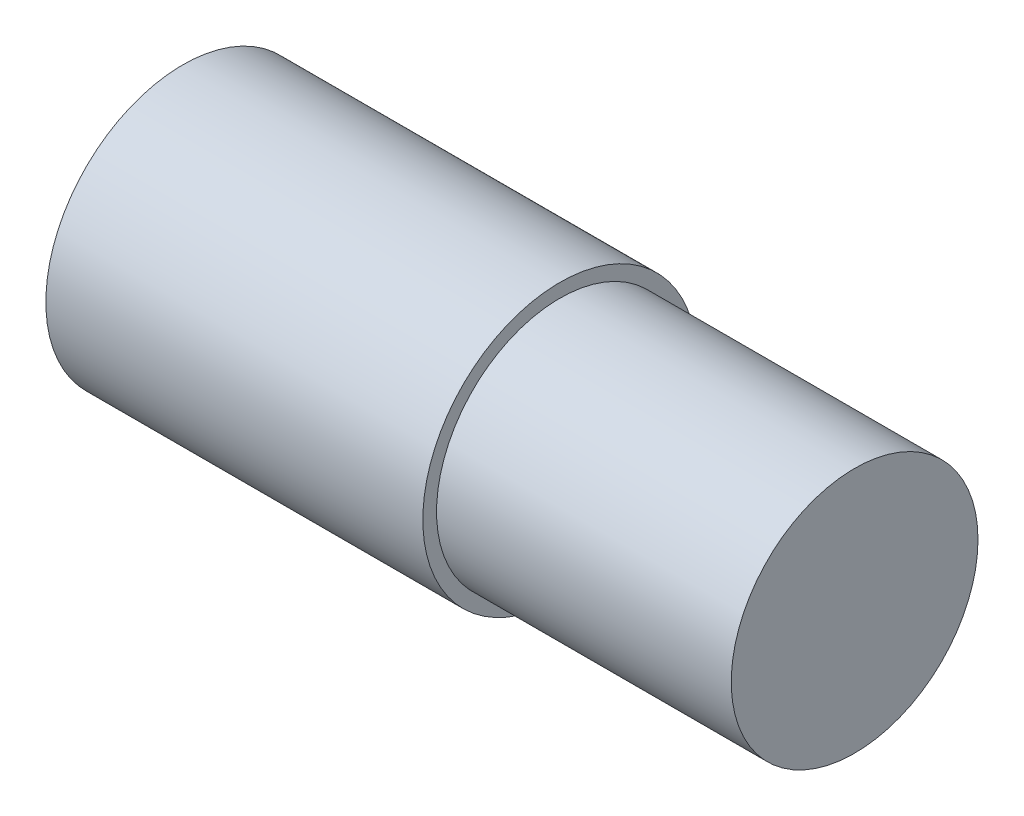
SolidWorks part; units mm, degrees
ref_plane "Front Plane" through (0, 0, 0) normal (0, 0, 1) x (1, 0, 0)
ref_plane "Top Plane" through (0, 0, 0) normal (0, 1, 0) x (1, 0, 0)
ref_plane "Right Plane" through (0, 0, 0) normal (1, 0, 0) x (0, 0, -1)
sketch "Sketch1" plane through (0, 0, 0) normal (1, 0, 0) x (0, 0, -1)
  circle A0 centre (0, 0) radius 200
extrude "Boss-Extrude1" add sketch "Sketch1" along normal blind 550
sketch "Sketch2" plane through (0, 0, 0) normal (1, 0, 0) x (0, 0, -1)
  circle A0 centre (0, 0) radius 60
extrude "Boss-Extrude2" add sketch "Sketch2" along normal blind 800
sketch "Sketch3" plane through (0, 0, 0) normal (1, 0, 0) x (0, 0, -1)
  circle A0 centre (0, 0) radius 180
extrude "Boss-Extrude3" add sketch "Sketch3" along normal blind 980
